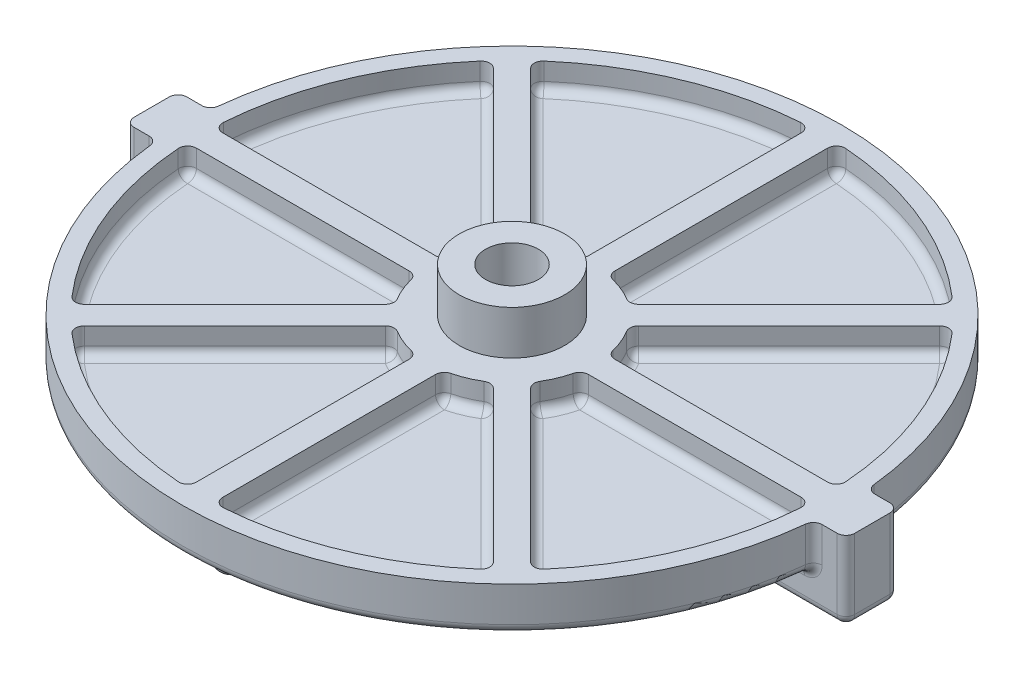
SolidWorks part; units mm, degrees
ref_plane "Front" through (0, 0, 0) normal (0, 0, 1) x (1, 0, 0)
ref_plane "Top" through (0, 0, 0) normal (0, 1, 0) x (1, 0, 0)
ref_plane "Right" through (0, 0, 0) normal (1, 0, 0) x (0, 0, -1)
sketch "Sketch1" plane through (0, 0, 0) normal (0, 1, 0) x (1, 0, 0)
  circle A0 centre (0, 0) radius 37.5
  dimension "D1" = 75
extrude "Base-Extrude" add sketch "Sketch1" along normal blind 5
shell "Shell1" thickness 2
ref_plane "Plane1" through (0, 10, 0) normal (0, 1, 0) x (-1, 0, 0)
sketch "Sketch2" plane through (0, 10, 0) normal (0, 1, 0) x (-1, 0, 0)
  circle A0 centre (0, 0) radius 6
  dimension "D1" = 12
extrude "Boss-Extrude1" add sketch "Sketch2" against normal up to next
sketch "Sketch3" plane through (0, 2, 0) normal (0, 1, 0) x (-1, 0, 0)
  circle A0 centre (0, 0) radius 9.5
  dimension "D1" = 19
extrude "Boss-Extrude2" add sketch "Sketch3" along normal up to surface
sketch "Sketch4" plane through (0, 0, 0) normal (0, -1, 0) x (1, 0, 0)
  line L0 (0, 0) -> (23.671, 0) construction
  line L1 (-41, 3) -> (41, 3)
  line L2 (-41, -3) -> (41, -3)
  line L3 (41, 3) -> (41, -3)
  line L4 (0, -14.0665) -> (0, 14.0665) construction
  line L5 (-41, 3) -> (-41, -3)
  point P5 (0, 3)
  point P11 (0, -3)
  dimension "D1" = 6
  dimension "D2" = 82
extrude "Boss-Extrude3" add sketch "Sketch4" along normal blind 4
sketch "Sketch5" plane through (0, 0, 0) normal (0, 1, 0) x (-1, 0, 0)
  line L3 (-37.3798, 3) -> (-41, 3)
  line L4 (-41, 3) -> (-41, -3)
  line L5 (-41, -3) -> (-37.3798, -3)
  line L6 (-37.3798, 3) -> (-41, 3)
  line L7 (-41, 3) -> (-41, -3)
  line L8 (-41, -3) -> (-37.3798, -3)
  arc A1 (-37.3798, 3) -> (-37.3798, -3) centre (0, 0) ccw
  arc A2 (-37.3798, 3) -> (-37.3798, -3) centre (0, 0) ccw
  dimension "D1" = 0
extrude "Boss-Extrude4" add sketch "Sketch5" along normal up to surface
sketch "Sketch6" plane through (0, 0, 0) normal (0, 1, 0) x (-1, 0, 0)
  line L3 (37.3798, -3) -> (41, -3)
  line L4 (41, -3) -> (41, 3)
  line L5 (41, 3) -> (37.3798, 3)
  line L6 (37.3798, -3) -> (41, -3)
  line L7 (41, -3) -> (41, 3)
  line L8 (41, 3) -> (37.3798, 3)
  arc A1 (37.3798, -3) -> (37.3798, 3) centre (0, 0) ccw
  arc A2 (37.3798, -3) -> (37.3798, 3) centre (0, 0) ccw
  dimension "D1" = 0
extrude "Boss-Extrude5" add sketch "Sketch6" along normal up to surface
sketch "Sketch7" plane through (0, 5, 0) normal (0, 1, 0) x (-1, 0, 0)
  line L0 (0, 0) -> (-46.2077, 0) construction
  line L1 (-9.3808, 1.5) -> (-35.4683, 1.5)
  line L2 (-9.3808, -1.5) -> (-35.4683, -1.5)
  circle A0 centre (0, 0) radius 9.5 construction
  circle A1 centre (0, 0) radius 35.5 construction
  arc A2 (-35.4683, 1.5) -> (-35.4683, -1.5) centre (0, 0) ccw
  arc A3 (-9.3808, 1.5) -> (-9.3808, -1.5) centre (0, 0) ccw
  dimension "D1" = 3
extrude "Boss-Extrude6" add sketch "Sketch7" against normal up to surface
sketch "Sketch8" plane through (0, 0, 0) normal (0, -1, 0) x (1, 0, 0)
  line L0 (0, 0) -> (0, -32) construction
  line L1 (-1.5, -20) -> (-1.5, -32)
  line L2 (1.5, -20) -> (1.5, -32)
  line L3 (0, 0) -> (-15.8059, 0) construction
  line L4 (1.5, 20) -> (1.5, 32)
  line L5 (-1.5, 20) -> (-1.5, 32)
  arc A0 (-1.5, -20) -> (1.5, -20) centre (0, -20) cw
  arc A1 (1.5, -32) -> (-1.5, -32) centre (0, -32) cw
  arc A2 (1.5, 32) -> (-1.5, 32) centre (0, 32) ccw
  arc A3 (-1.5, 20) -> (1.5, 20) centre (0, 20) ccw
  dimension "D1" = 15
  dimension "D2" = 3
  dimension "D3" = 32
extrude "Boss-Extrude7" add sketch "Sketch8" along normal up to surface
fillet "Fillet1" radius 1 4 edges at (9.3808, 3.5, 1.5) (9.3808, 3.5, -1.5) (35.4683, 3.5, -1.5) (35.4683, 3.5, 1.5)
pattern_circular "CirPattern1" count 8 over 360 about axis through (0, 0, 0) along (0, 1, 0) of "Boss-Extrude6", "Fillet1"
fillet "Fillet2" radius 1 12 edges at (0, 0, -37.5) (0, 0, 37.5) (41, -4, 0) (-41, -4, 0) (0, 0, -18.5) (-1.5, 0, -26) (0, 0, -33.5) (1.5, 0, -26) (0, 0, 33.5) (-1.5, 0, 26) (0, 0, 18.5) (1.5, 0, 26)
fillet "Fillet3" radius 1 28 edges at (37.3798, 3, -3) (37.3798, 3, 3) (0, 0, -3) (0, 0, 3) (0, -4, 3) (0, -4, -3) (-37.3798, 3, 3) (-41, 1, -3) (41, 1, -3) (40.7071, -3.7071, -3) (-40.7071, -3.7071, -3) (-41, 1, 3) (41, 1, 3) (40.7071, -3.7071, 3) (-37.3798, 3, -3) (-40.7071, -3.7071, 3) (37.1612, 0.3768, 3) (-37.0049, 0.2204, 3) (-37.1612, 0.3768, -3) (37.0049, 0.2204, -3) (1.5, -4, -26) (0, -4, -18.5) (-1.5, -4, -26) (0, -4, -33.5) (1.5, -4, 26) (0, -4, 33.5) (-1.5, -4, 26) (0, -4, 18.5)
fillet "Fillet4" radius 1 64 edges at (22.3037, 2, -1.5) (32.7977, 2, -13.5853) (9.5808, 2, -1.7132) (35.1416, 2, -1.819) (35.1416, 2, 1.819) (9.5808, 2, 1.7132) (16.8317, 2, -14.7104) (26.1351, 2, -23.5626) (7.9861, 2, -5.5632) (13.5853, 2, -32.7977) (14.7104, 2, -16.8317) (3.6355, 2, -8.7769) (5.5632, 2, -7.9861) (23.5626, 2, -26.1351) (1.5, 2, -22.3037) (1.819, 2, -35.1416) (1.7132, 2, -9.5808) (-13.5853, 2, -32.7977) (-1.5, 2, -22.3037) (-3.6355, 2, -8.7769) (-1.7132, 2, -9.5808) (-1.819, 2, -35.1416) (-14.7104, 2, -16.8317) (-23.5626, 2, -26.1351) (-5.5632, 2, -7.9861) (-32.7977, 2, -13.5853) (-16.8317, 2, -14.7104) (-8.7769, 2, -3.6355) (-7.9861, 2, -5.5632) (-26.1351, 2, -23.5626) (-22.3037, 2, -1.5) (-35.1416, 2, -1.819) (-9.5808, 2, -1.7132) (-32.7977, 2, 13.5853) (-22.3037, 2, 1.5) (-8.7769, 2, 3.6355) (-9.5808, 2, 1.7132) (-35.1416, 2, 1.819) (-16.8317, 2, 14.7104) (-26.1351, 2, 23.5626) (-7.9861, 2, 5.5632) (-13.5853, 2, 32.7977) (-14.7104, 2, 16.8317) (-3.6355, 2, 8.7769) (-5.5632, 2, 7.9861) (-23.5626, 2, 26.1351) (-1.5, 2, 22.3037) (-1.819, 2, 35.1416) (-1.7132, 2, 9.5808) (13.5853, 2, 32.7977) (1.5, 2, 22.3037) (3.6355, 2, 8.7769) (1.7132, 2, 9.5808) (1.819, 2, 35.1416) (14.7104, 2, 16.8317) (23.5626, 2, 26.1351) (5.5632, 2, 7.9861) (32.7977, 2, 13.5853) (16.8317, 2, 14.7104) (8.7769, 2, 3.6355) (7.9861, 2, 5.5632) (26.1351, 2, 23.5626) (8.7769, 2, -3.6355) (22.3037, 2, 1.5)
sketch "Sketch9" plane through (0, 10, 0) normal (0, 1, 0) x (-1, 0, 0)
  circle A0 centre (0, 0) radius 3
  dimension "D1" = 6
extrude "Cut-Extrude1" cut sketch "Sketch9" against normal blind 8
sketch "Wedge Pocket Sketch" plane through (0, 5, 0) normal (0, 1, 0) x (-1, 0, 0)
  line L0 (25.3917, -23.2704) -> (8.2718, -6.1504) construction
  line L1 (10.198, -1.5) -> (34.4093, -1.5) construction
  line L2 (25.3917, -23.2704) -> (8.2718, -6.1504)
  line L3 (10.198, -1.5) -> (34.4093, -1.5)
  arc A0 (25.3917, -23.2704) -> (26.8553, -23.2173) centre (26.0988, -22.5633) ccw construction
  arc A1 (8.1237, -4.9249) -> (8.2718, -6.1504) centre (8.9789, -5.4433) ccw construction
  arc A2 (8.1237, -4.9249) -> (9.2268, -2.2619) centre (0, 0) ccw construction
  arc A3 (10.198, -1.5) -> (9.2268, -2.2619) centre (10.198, -2.5) ccw construction
  arc A4 (35.4067, -2.5725) -> (34.4093, -1.5) centre (34.4093, -2.5) ccw construction
  arc A5 (26.8553, -23.2173) -> (35.4067, -2.5725) centre (0, 0) ccw construction
  arc A6 (25.3917, -23.2704) -> (26.8553, -23.2173) centre (26.0988, -22.5633) ccw
  arc A7 (8.1237, -4.9249) -> (8.2718, -6.1504) centre (8.9789, -5.4433) ccw
  arc A8 (8.1237, -4.9249) -> (9.2268, -2.2619) centre (0, 0) ccw
  arc A9 (10.198, -1.5) -> (9.2268, -2.2619) centre (10.198, -2.5) ccw
  arc A10 (35.4067, -2.5725) -> (34.4093, -1.5) centre (34.4093, -2.5) ccw
  arc A11 (26.8553, -23.2173) -> (35.4067, -2.5725) centre (0, 0) ccw
